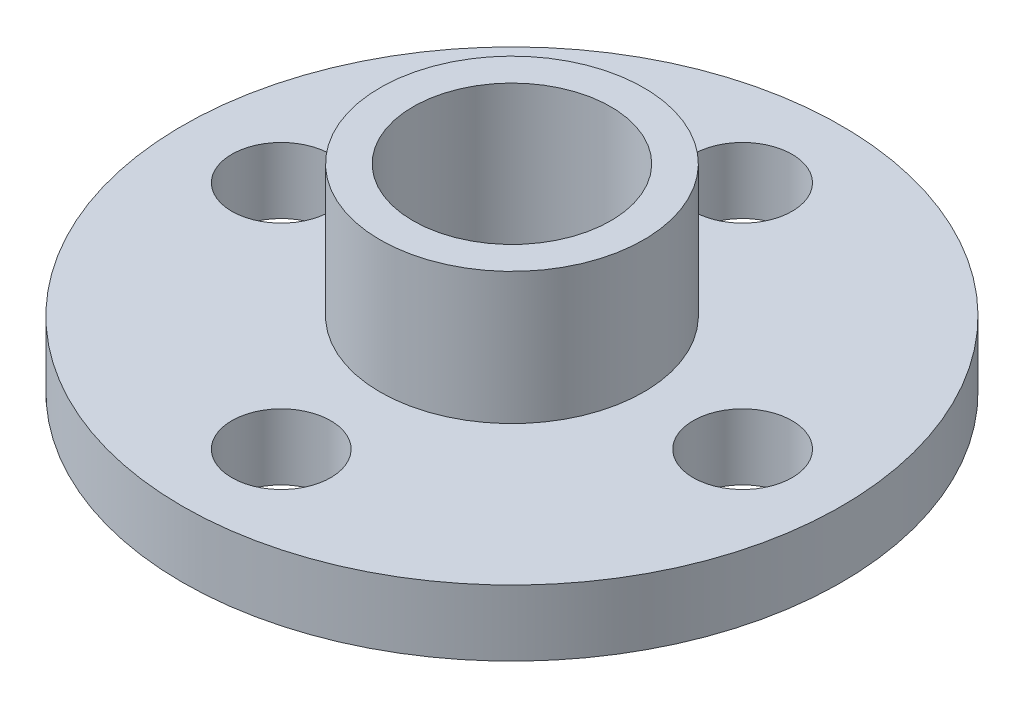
SolidWorks part; units mm, degrees
ref_plane "Front Plane" through (0, 0, 0) normal (0, 0, 1) x (1, 0, 0)
ref_plane "Top Plane" through (0, 0, 0) normal (0, 1, 0) x (1, 0, 0)
ref_plane "Right Plane" through (0, 0, 0) normal (1, 0, 0) x (0, 0, -1)
sketch "Sketch1" plane through (0, 0, 0) normal (0, 1, 0) x (1, 0, 0)
  circle A0 centre (0, 0) radius 10
  circle A2 centre (0, 7) radius 1.5
  circle A6 centre (7, 0) radius 1.5
  circle A7 centre (0, -7) radius 1.5
  circle A8 centre (-7, 0) radius 1.5
  point P14 (0, 0)
  point P15 (0, 0)
  dimension "D1" = 20
  dimension "D2" = 3
  dimension "D3" = 7
  dimension "D4" = 4
extrude "Boss-Extrude1" add sketch "Sketch1" along normal blind 2
sketch "Sketch2" plane through (0, 2, 0) normal (0, 1, 0) x (1, 0, 0)
  circle A0 centre (0, 0) radius 4
  circle A1 centre (0, 0) radius 3
  dimension "D1" = 6
  dimension "D2" = 8
extrude "Boss-Extrude2" add sketch "Sketch2" along normal blind 4
sketch "Sketch3" plane through (0, 2, 0) normal (0, 1, 0) x (1, 0, 0)
  circle A0 centre (0, 0) radius 3
extrude "Cut-Extrude1" cut sketch "Sketch3" against normal blind 4
